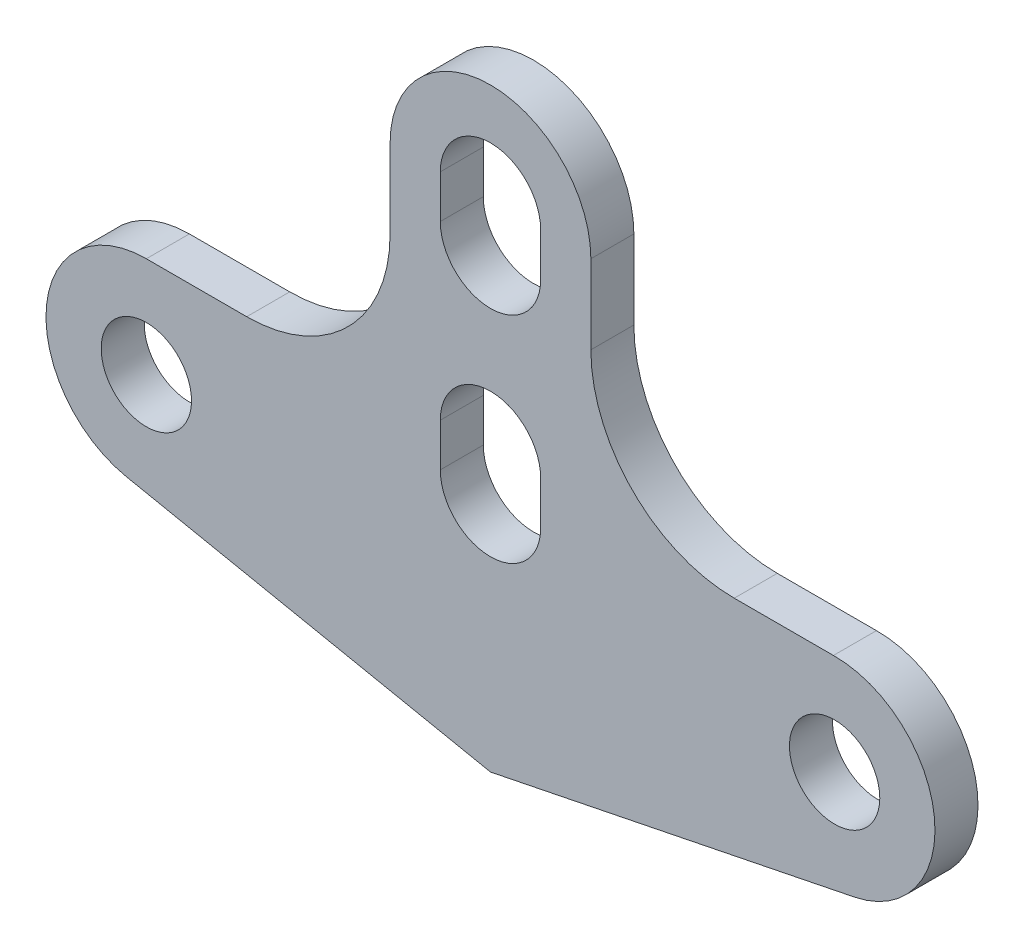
SolidWorks part; units mm, degrees
ref_plane "Face" through (0, 0, 0) normal (0, 0, 1) x (1, 0, 0)
ref_plane "Dessus" through (0, 0, 0) normal (0, 1, 0) x (1, 0, 0)
ref_plane "Droite" through (0, 0, 0) normal (1, 0, 0) x (0, 0, -1)
sketch "Esquisse1" plane through (0, 0, 0) normal (0, 0, 1) x (1, 0, 0)
  line L0 (3.5, -15) -> (3.5, -18)
  line L1 (-7, 0) -> (-7, -5.5)
  line L2 (-17, -15.5) -> (-24, -15.5)
  line L3 (7, 0) -> (7, -5.5005)
  line L4 (17, -15.5005) -> (23.917, -15.5005)
  line L5 (-25.3888, -29.3609) -> (0, -34.5)
  line L6 (0, -34.5) -> (25.3888, -29.3609)
  line L7 (-3.5, -15) -> (-3.5, -18)
  line L8 (3.5, 0) -> (3.5, -3)
  line L9 (-3.5, 0) -> (-3.5, -3)
  arc A0 (3.5, -3) -> (-3.5, -3) centre (0, -3) cw
  arc A1 (-3.5, -15) -> (3.5, -15) centre (0, -15) cw
  arc A2 (7, 0) -> (-3.1297, 6.2614) centre (0, 0) ccw
  circle A3 centre (-24, -22.5) radius 3.15
  circle A4 centre (24, -22.5) radius 3.15
  arc A5 (-24, -15.5) -> (-25.3888, -29.3609) centre (-24, -22.5) ccw
  arc A6 (25.3888, -29.3609) -> (23.917, -15.5005) centre (24, -22.5) ccw
  arc A7 (7, -5.5005) -> (17, -15.5005) centre (17, -5.5005) ccw
  arc A8 (-17, -15.5) -> (-7, -5.5) centre (-17, -5.5) ccw
  arc A10 (-3.5, 0) -> (3.5, 0) centre (0, 0) cw
  arc A11 (-3.1297, 6.2614) -> (-7, 0) centre (0, 0) ccw
  arc A12 (-3.5, -18) -> (3.5, -18) centre (0, -18) ccw
  dimension "D2" = 14
  dimension "D6" = 6.3
  dimension "D7" = 14
  dimension "D8" = 10
  dimension "D3" = 3
  dimension "D9" = 4.5
  dimension "D11" = 3.5
  dimension "D12" = 15
  dimension "D4" = 48
  dimension "D5" = 24
  dimension "D10" = 16.5
  dimension "D13" = 3
extrude "Extrusion2" add sketch "Esquisse1" along normal blind 3
